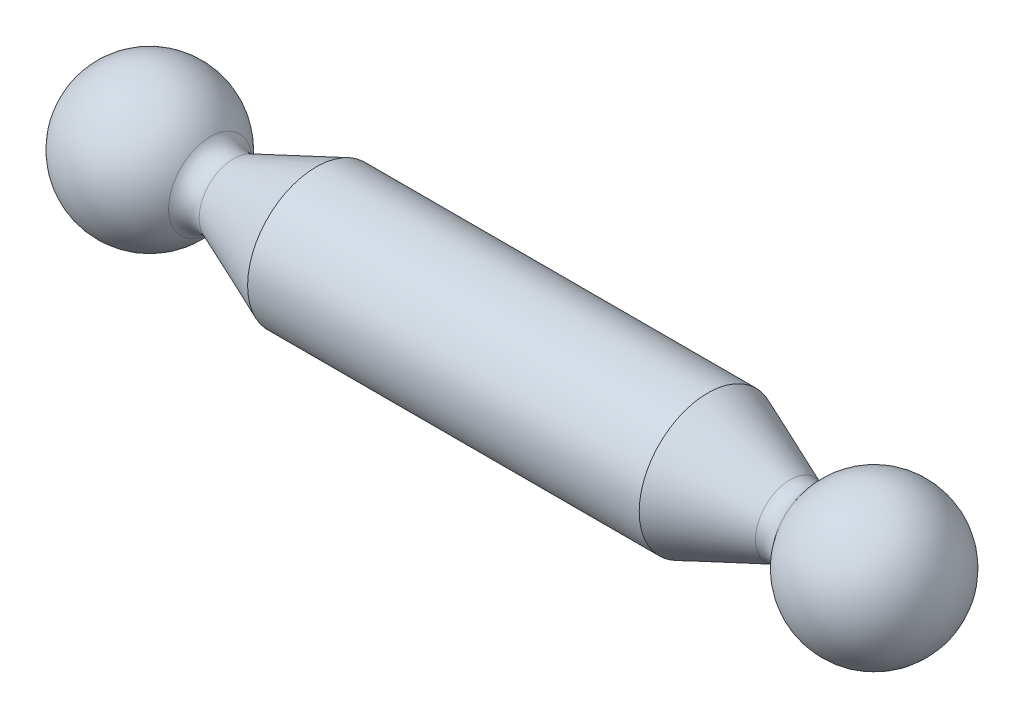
SolidWorks part; units mm, degrees
ref_plane "Plan1" through (0, 0, 0) normal (0, 0, 1) x (1, 0, 0)
ref_plane "Plan2" through (0, 0, 0) normal (0, 1, 0) x (1, 0, 0)
ref_plane "Plan3" through (0, 0, 0) normal (1, 0, 0) x (0, 0, -1)
sketch "Esquisse1" plane through (0, 0, 0) normal (0, 1, 0) x (1, 0, 0)
  line L0 (0, 0) -> (74, 0) construction
  line L1 (0, 0) -> (74, 0) construction
  line L2 (17, 7) -> (57, 7)
  line L3 (17, 7) -> (8.5876, 3.5361)
  line L4 (57, 7) -> (65.4124, 3.5361)
  line L5 (-7.5, 0) -> (81.5, 0)
  arc A0 (6.1785, 4.2516) -> (-7.5, 0) centre (0, 0) ccw
  arc A1 (81.5, 0) -> (67.8215, 4.2516) centre (74, 0) ccw
  arc A2 (67.8215, 4.2516) -> (65.4124, 3.5361) centre (66.1739, 5.3854) cw
  arc A3 (8.5876, 3.5361) -> (6.1785, 4.2516) centre (7.8261, 5.3854) cw
  dimension "D1" = 74
  dimension "D2" = 15
  dimension "D3" = 2
  dimension "D4" = 14
revolve "Révolution2" add sketch "Esquisse1" angle 360 about L5
